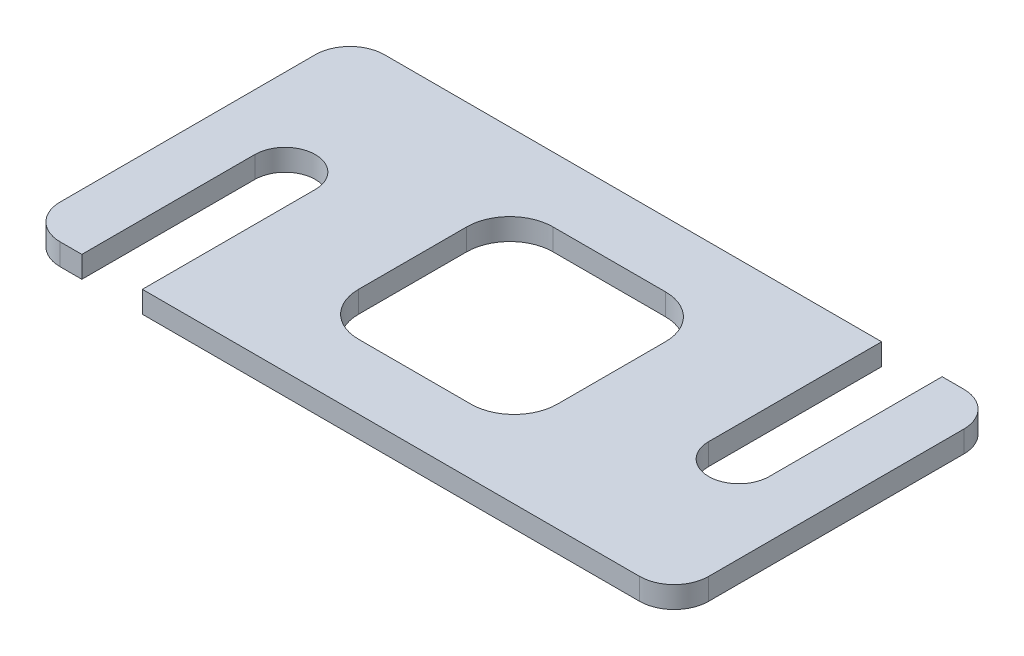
SolidWorks part; units mm, degrees
ref_plane "Front Plane" through (0, 0, 0) normal (0, 0, 1) x (1, 0, 0)
ref_plane "Top Plane" through (0, 0, 0) normal (0, 1, 0) x (1, 0, 0)
ref_plane "Right Plane" through (0, 0, 0) normal (1, 0, 0) x (0, 0, -1)
sketch "Sketch1" plane through (0, 0, 0) normal (0, 1, 0) x (1, 0, 0)
  line L1 (0, 0) -> (150, 0)
  line L2 (0, 0) -> (0, 75)
  line L3 (0, 75) -> (150, 75)
  line L4 (150, 0) -> (150, 75)
  dimension "D1" = 150
  dimension "D2" = 75
extrude "Boss-Extrude1" add sketch "Sketch1" along normal blind 5
sketch "Sketch2" plane through (0, 5, 0) normal (0, 1, 0) x (1, 0, 0)
  line L0 (13, 0) -> (13, 40)
  line L1 (0, 0) -> (150, 0) construction
  line L2 (27, 40) -> (27, 0)
  line L3 (27, 0) -> (13, 0)
  line L4 (20, 40) -> (20, 0) construction
  line L5 (0, 75) -> (0, 0) construction
  arc A0 (13, 40) -> (27, 40) centre (20, 40) cw
  dimension "D2" = 40
  dimension "D3" = 7
  dimension "D1" = 20
extrude "Cut-Extrude1" cut sketch "Sketch2" against normal through all
sketch "Sketch3" plane through (0, 5, 0) normal (0, 1, 0) x (1, 0, 0)
  line L0 (123, 35) -> (123, 75)
  line L2 (137, 75) -> (137, 35)
  line L3 (123, 75) -> (137, 75)
  line L4 (130, 75) -> (130, 35) construction
  line L6 (150, 75) -> (0, 75) construction
  line L8 (150, 0) -> (150, 75) construction
  arc A0 (123, 35) -> (137, 35) centre (130, 35) ccw
  dimension "D2" = 40
  dimension "D3" = 7
  dimension "D1" = 20
extrude "Cut-Extrude2" cut sketch "Sketch3" against normal through all
sketch "Sketch4" plane through (0, 5, 0) normal (0, 1, 0) x (1, 0, 0)
  line L0 (27, 0) -> (27, 40) construction
  line L1 (52, 15) -> (98, 15)
  line L2 (52, 15) -> (52, 60)
  line L3 (52, 60) -> (98, 60)
  line L4 (98, 15) -> (98, 60)
  line L5 (123, 75) -> (123, 35) construction
  line L6 (27, 0) -> (150, 0) construction
  line L7 (123, 75) -> (0, 75) construction
  dimension "D1" = 25
  dimension "D2" = 25
  dimension "D3" = 15
  dimension "D4" = 15
extrude "Cut-Extrude3" cut sketch "Sketch4" against normal through all
fillet "Fillet1" radius 10 4 edges at (52, 2.5, -60) (98, 2.5, -60) (98, 2.5, -15) (52, 2.5, -15)
fillet "Fillet2" radius 8 4 edges at (0, 2.5, 0) (150, 2.5, 0) (150, 2.5, -75) (0, 2.5, -75)
